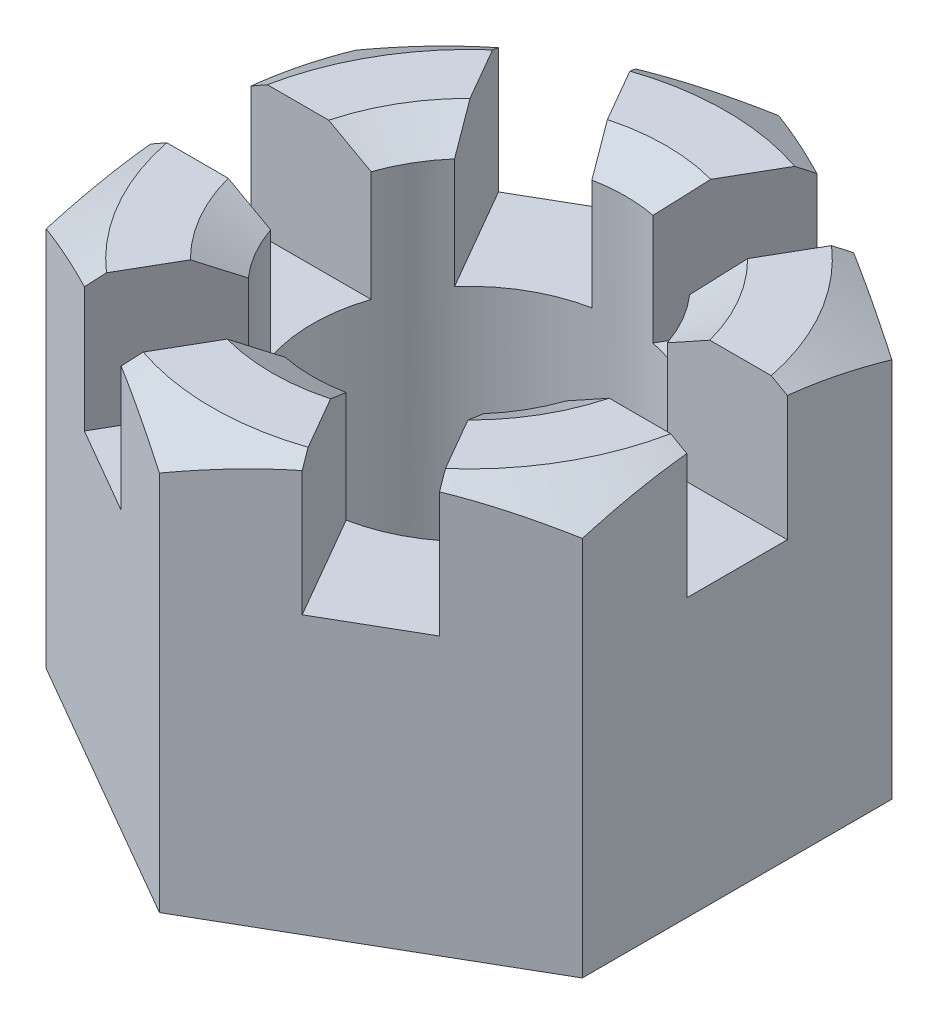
SolidWorks part; units mm, degrees
ref_plane "Front Plane" through (0, 0, 0) normal (0, 0, 1) x (1, 0, 0)
ref_plane "Top Plane" through (0, 0, 0) normal (0, 1, 0) x (1, 0, 0)
ref_plane "Right Plane" through (0, 0, 0) normal (1, 0, 0) x (0, 0, -1)
sketch "BaseNutSke" plane through (0, 0, 0) normal (0, 1, 0) x (1, 0, 0)
  line L1 (0, 13.8564) -> (-12, 6.9282)
  line L2 (-12, 6.9282) -> (-12, -6.9282)
  line L3 (-12, -6.9282) -> (0, -13.8564)
  line L4 (0, -13.8564) -> (12, -6.9282)
  line L5 (12, -6.9282) -> (12, 6.9282)
  line L6 (12, 6.9282) -> (0, 13.8564)
  circle A0 centre (0, 0) radius 12 construction
  dimension "Width" = 24
extrude "BaseNut" add sketch "BaseNutSke" along normal blind 19
sketch "CutNutSke" plane through (0, 0, 0) normal (1, 0, 0) x (0, 0, -1)
  line L0 (-13.8564, 19) -> (-11.5, 19)
  line L1 (-11.5, 19) -> (-13.8564, 17.6395)
  line L2 (-13.8564, 17.6395) -> (-13.8564, 19)
  line L3 (0, 0) -> (0, 8.4136) construction
  dimension "Chamf_ang" = 30
  dimension "Chamfer_diameter" = 23
revolve "CutNut" cut sketch "CutNutSke" angle 360 about L3
sketch "HoleSke" plane through (0, 0, 0) normal (0, 1, 0) x (1, 0, 0)
  circle A0 centre (0, 0) radius 7
  dimension "Tap_drill" = 14
extrude "TappedHole" cut sketch "HoleSke" along normal through all
chamfer "Chamfer1" distance 1.05 angle 60 2 edges at (0, 19, 7) (0, 0, 7)
sketch "SlotSke" plane through (0, 0, 0) normal (1, 0, 0) x (0, 0, -1)
  line L0 (0, 0) -> (0, 7.747) construction
  line L2 (-2.25, 32) -> (2.25, 32)
  line L3 (-2.25, 32) -> (-2.25, 13)
  line L4 (-2.25, 13) -> (2.25, 13)
  line L5 (2.25, 32) -> (2.25, 13)
  dimension "D1" = 19
  dimension "Slot_height" = 13
  dimension "Slot_width" = 4.5
extrude "Slot" cut sketch "SlotSke" against normal blind 28.8
pattern_circular "SlotPat" count 6 over 360 about axis through (0, 0, 0) along (0, 1, 0) of "Slot"
sketch "CutBottomSke" plane through (0, 0, 0) normal (0, 1, 0) x (1, 0, 0)
  circle A0 centre (0, 0) radius 11.15
  circle A1 centre (0, 0) radius 22.3
  dimension "D1" = 44.6
  dimension "Bottom_diameter" = 22.3
extrude "CutBottom" cut sketch "CutBottomSke" along normal blind 0.6
sketch "ThdSchSke" plane through (0, 0, 0) normal (0, 0, 1) x (1, 0, 0)
  line L0 (-8, 1.6274) -> (-7, 1.05)
  line L1 (-7, 1.05) -> (-5.8453, 1.05)
  line L2 (-5.8453, 1.05) -> (-5.8453, 2.2047)
  line L3 (-5.8453, 2.2047) -> (-7, 2.2047)
  line L4 (-7, 2.2047) -> (-8, 1.6274)
  line L5 (0, -3.4988) -> (0, 3.4988) construction
  line L8 (7, 1.05) -> (-7, 1.05) construction
  line L9 (7, 1.05) -> (-7, 1.05) construction
  dimension "ThreadN" = 16
  dimension "Tap_drill" = 14
revolve "ThreadSchematic" [suppressed] cut sketch "ThdSchSke" angle 360 about L5
pattern_linear "ThdSchPat" [suppressed]
equation "\"D1@Chamfer1\" = \"Tap_drill@HoleSke\"*0.075"
equation "\"D1@SlotSke\" = \"Height@BaseNut\""
equation "\"D1@Slot\" = \"Width@BaseNutSke\"*1.2"
equation "\"D1@CutBottomSke\" = \"Bottom_diameter@CutBottomSke\"*2"
equation "\"Tap_drill@ThdSchSke\" = \"Tap_drill@HoleSke\""
equation "\"ThreadN@ThdSchSke\" = \"Thread_major@ThreadCosmetic\""
equation "\"Num_threads@ThdSchPat\" =  int(( \"Height@BaseNut\" - \"D1@Chamfer1\" *2) /\"Advance@ThdSchPat\" ) "
